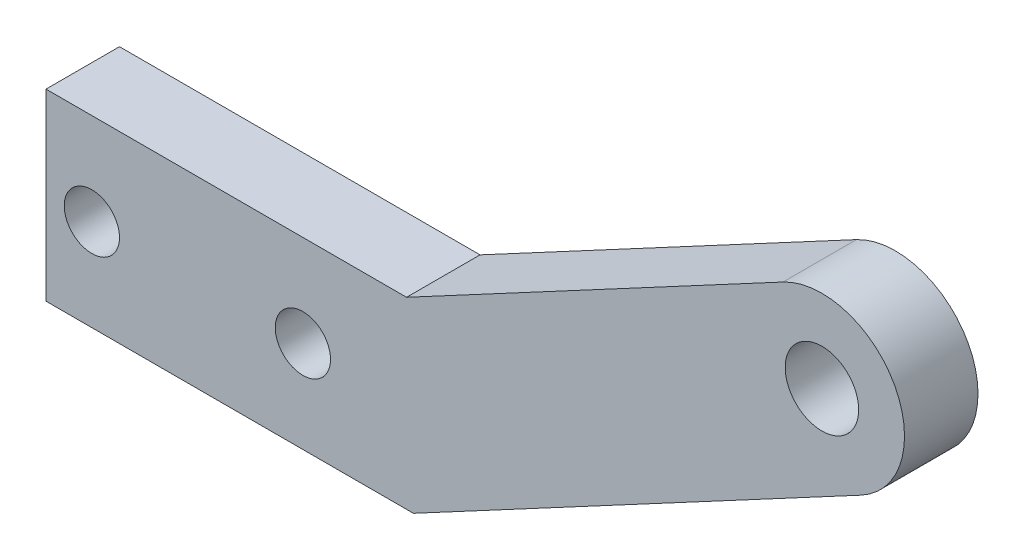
SolidWorks part; units mm, degrees
ref_plane "Front Plane" through (0, 0, 0) normal (0, 0, 1) x (1, 0, 0)
ref_plane "Top Plane" through (0, 0, 0) normal (0, 1, 0) x (1, 0, 0)
ref_plane "Right Plane" through (0, 0, 0) normal (1, 0, 0) x (0, 0, -1)
sketch "Sketch1" plane through (0, 0, 0) normal (0, 0, 1) x (1, 0, 0)
  line L0 (0, 0) -> (-34.8883, 0) construction
  line L1 (0, 0) -> (0, -7.9375)
  line L2 (0, -7.9375) -> (31.75, -7.9375)
  line L4 (31.1613, 7.9375) -> (0, 7.9375)
  line L5 (0, 7.9375) -> (0, 0)
  line L6 (31.75, -7.9375) -> (70.4235, 12.7569)
  line L7 (31.1613, 7.9375) -> (63.6885, 25.3431)
  line L8 (0, 0) -> (3.9624, 0) construction
  line L9 (3.9624, 0) -> (22.1996, 0) construction
  line L10 (22.1996, 0) -> (52.1587, 0) construction
  line L11 (13.081, 0) -> (13.081, -11.5312) construction
  circle A0 centre (3.9624, 0) radius 2.3876
  circle A1 centre (22.1996, 0) radius 2.3876
  circle A2 centre (67.056, 19.05) radius 3.175
  circle A3 centre (67.056, 19.05) radius 7.1374
  dimension "D4" = 4.7752
  dimension "D5" = 6.35
  dimension "D7" = 31.75
  dimension "D8" = 14.2748
  dimension "D1" = 15.875
  dimension "D2" = 3.9624
  dimension "D3" = 18.2372
  dimension "D6" = 19.05
  dimension "D9" = 53.975
sketch "Sketch2" plane through (0, 0, 0) normal (0, 0, 1) x (1, 0, 0)
  line L0 (0, -7.9375) -> (31.75, -7.9375) construction
  line L2 (31.1613, 7.9375) -> (0, 7.9375) construction
  line L3 (0, 7.9375) -> (0, 0) construction
  line L4 (0, 0) -> (0, -7.9375) construction
  line L5 (0, -7.9375) -> (31.75, -7.9375)
  line L6 (31.75, -7.9375) -> (70.4235, 12.7569) construction
  line L7 (31.1613, 7.9375) -> (0, 7.9375)
  line L8 (0, 7.9375) -> (0, 0)
  line L9 (0, 0) -> (0, -7.9375)
  line L10 (31.1613, 7.9375) -> (63.6885, 25.3431) construction
  line L11 (31.75, -7.9375) -> (70.4235, 12.7569)
  line L12 (31.1613, 7.9375) -> (63.6885, 25.3431)
  circle A0 centre (3.9624, 0) radius 2.3876 construction
  circle A1 centre (22.1996, 0) radius 2.3876 construction
  circle A2 centre (67.056, 19.05) radius 3.175 construction
  circle A3 centre (3.9624, 0) radius 2.3876
  circle A4 centre (22.1996, 0) radius 2.3876
  circle A5 centre (67.056, 19.05) radius 3.175
  circle A6 centre (67.056, 19.05) radius 7.1374 construction
  arc A7 (70.4235, 12.7569) -> (63.6885, 25.3431) centre (67.056, 19.05) ccw
extrude "Boss-Extrude1" add sketch "Sketch2" along normal blind 6.35
sketch "Sketch3" plane through (0, 0, 0) normal (0, 0, 1) x (1, 0, 0)
  line L0 (0, 0) -> (25.4, 0) construction
  line L1 (0, 3.175) -> (25.4, 3.175)
  line L2 (0, -3.175) -> (25.4, -3.175)
  arc A0 (0, 3.175) -> (0, -3.175) centre (0, 0) ccw
  arc A1 (25.4, -3.175) -> (25.4, 3.175) centre (25.4, 0) ccw
  point P3 (12.7, 0)
  dimension "D1" = 25.4
  dimension "D2" = 6.35
sketch "Sketch5" plane through (0, 0, 0) normal (0, 0, 1) x (1, 0, 0)
  line L0 (0, -3.175) -> (25.4, -3.175) construction
  line L1 (0, 3.175) -> (25.4, 3.175) construction
  line L2 (0, -3.175) -> (25.4, -3.175)
  line L3 (0, 3.175) -> (25.4, 3.175)
  arc A0 (25.4, -3.175) -> (25.4, 3.175) centre (25.4, 0) ccw construction
  arc A1 (0, 3.175) -> (0, -3.175) centre (0, 0) ccw construction
  arc A2 (25.4, -3.175) -> (25.4, 3.175) centre (25.4, 0) ccw
  arc A3 (0, 3.175) -> (0, -3.175) centre (0, 0) ccw
extrude "Cut-Extrude1" cut sketch "Sketch5" along normal blind 2.794
sketch "Sketch7" [suppressed] plane through (0, 0, 6.35) normal (0, 0, 1) x (1, 0, 0)
  line L0 (0, -3.175) -> (25.4, -3.175) construction
  line L1 (0, 3.175) -> (25.4, 3.175) construction
  line L2 (0, -3.175) -> (25.4, -3.175)
  line L3 (0, 3.175) -> (25.4, 3.175)
  arc A0 (25.4, -3.175) -> (25.4, 3.175) centre (25.4, 0) ccw construction
  arc A1 (0, 3.175) -> (0, -3.175) centre (0, 0) ccw construction
  arc A2 (25.4, -3.175) -> (25.4, 3.175) centre (25.4, 0) ccw
  arc A3 (0, 3.175) -> (0, -3.175) centre (0, 0) ccw
extrude "Cut-Extrude2" [suppressed] cut sketch "Sketch7" against normal blind 2.794
fillet "Fillet1" [suppressed] radius 3.175
